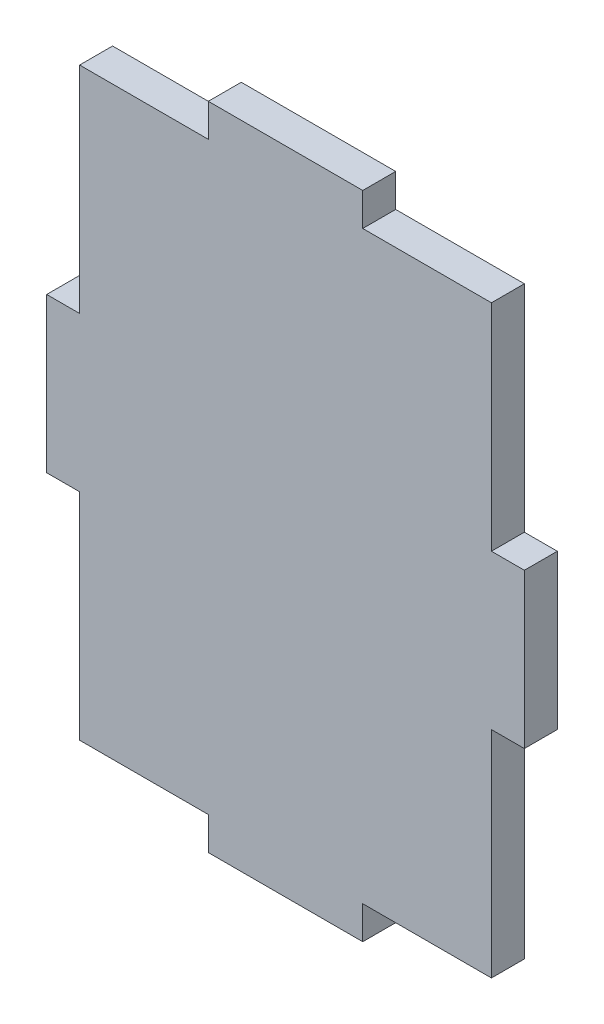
SolidWorks part; units mm, degrees
ref_plane "Front Plane" through (0, 0, 0) normal (0, 0, 1) x (1, 0, 0)
ref_plane "Top Plane" through (0, 0, 0) normal (0, 1, 0) x (1, 0, 0)
ref_plane "Right Plane" through (0, 0, 0) normal (1, 0, 0) x (0, 0, -1)
sketch "Sketch1" plane through (0, 0, 0) normal (0, 0, 1) x (1, 0, 0)
  line L0 (100, 284) -> (100, 0) construction
  line L1 (0, 0) -> (200, 0)
  line L2 (0, 0) -> (0, 284)
  line L3 (0, 284) -> (200, 284)
  line L4 (200, 0) -> (200, 284)
  line L5 (62.5, 284) -> (137.5, 284)
  line L6 (62.5, 284) -> (62.5, 300)
  line L7 (62.5, 300) -> (137.5, 300)
  line L8 (137.5, 284) -> (137.5, 300)
  line L9 (200, 179.5) -> (216, 179.5)
  line L10 (200, 179.5) -> (200, 104.5)
  line L11 (200, 104.5) -> (216, 104.5)
  line L12 (216, 179.5) -> (216, 104.5)
  line L13 (200, 142) -> (0, 142) construction
  line L14 (-16, 179.5) -> (-16, 104.5)
  line L15 (0, 104.5) -> (-16, 104.5)
  line L16 (0, 179.5) -> (0, 104.5)
  line L17 (0, 179.5) -> (-16, 179.5)
  line L18 (137.5, 0) -> (137.5, -16)
  line L19 (62.5, -16) -> (137.5, -16)
  line L20 (62.5, 0) -> (62.5, -16)
  line L21 (62.5, 0) -> (137.5, 0)
  point P10 (100, 300)
  point P11 (100, 284)
  point P16 (216, 142)
  point P17 (200, 142)
extrude "Boss-Extrude1" add sketch "Sketch1" along normal blind 16 contours L3 L8 L7 L6 | L12 L9 L4 L11 | L2 L17 L14 L15 | L19 L18 L21 L20
equation "\"thk\"= 16mm"
equation "\"D3@Sketch1\"=\"thk\""
equation "\"D5@Sketch1\"=\"thk\""
equation "\"D1@Boss-Extrude1\"=\"thk\""
